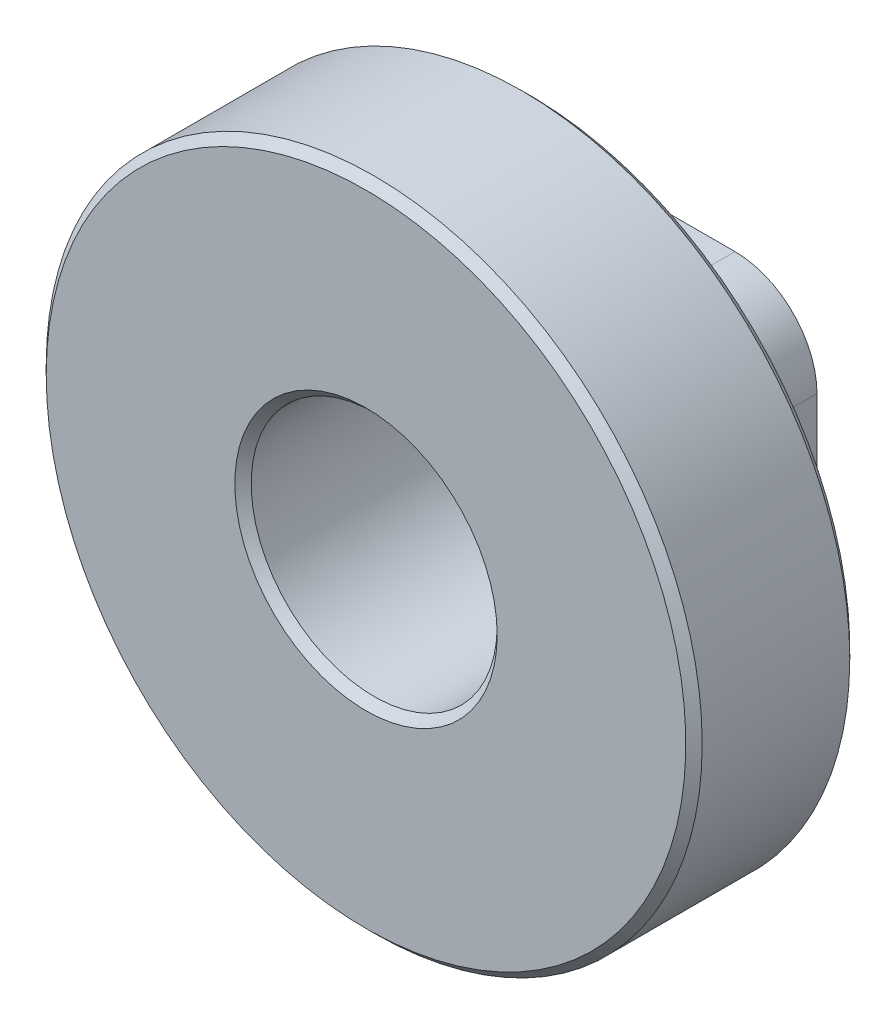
SolidWorks part; units mm, degrees
ref_plane "Face" through (0, 0, 0) normal (0, 0, 1) x (1, 0, 0)
ref_plane "Dessus" through (0, 0, 0) normal (0, 1, 0) x (1, 0, 0)
ref_plane "Droite" through (0, 0, 0) normal (1, 0, 0) x (0, 0, -1)
sketch "Esquisse1" plane through (0, 0, 0) normal (0, 0, 1) x (1, 0, 0)
  circle A0 centre (0, 0) radius 4
  circle A1 centre (0, 0) radius 1.5
  dimension "D1" = 8
  dimension "D2" = 3
extrude "Tube de base" add sketch "Esquisse1" along normal mid plane 3
sketch "Esquisse3" plane through (0, 0, -1.5) normal (0, 0, -1) x (-1, 0, 0)
  line L0 (2.5, 0) -> (0, 0) construction
  line L1 (-1.5, 2.5) -> (1.5, 2.5)
  line L2 (-2.5, 1.5) -> (-2.5, -1.5)
  line L3 (-1.5, -2.5) -> (1.5, -2.5)
  line L4 (2.5, 1.5) -> (2.5, -1.5)
  line L5 (0, 2.5) -> (0, 0) construction
  arc A0 (-2.5, 1.5) -> (-1.5, 2.5) centre (-1.5, 1.5) cw
  arc A1 (-1.5, -2.5) -> (-2.5, -1.5) centre (-1.5, -1.5) cw
  arc A2 (2.5, -1.5) -> (1.5, -2.5) centre (1.5, -1.5) cw
  arc A3 (1.5, 2.5) -> (2.5, 1.5) centre (1.5, 1.5) cw
  point P9 (-2.5, 2.5)
  point P16 (2.5, 2.5)
  dimension "D2" = 1
  dimension "D1" = 5
extrude "Méplats" cut sketch "Esquisse3" against normal blind 1 flip side to cut
chamfer "Chanfrein1" distance 0.1 angle 45
chamfer "Chanfrein2" distance 0.1 angle 45
chamfer "Chanfrein3" distance 0.1 angle 45
